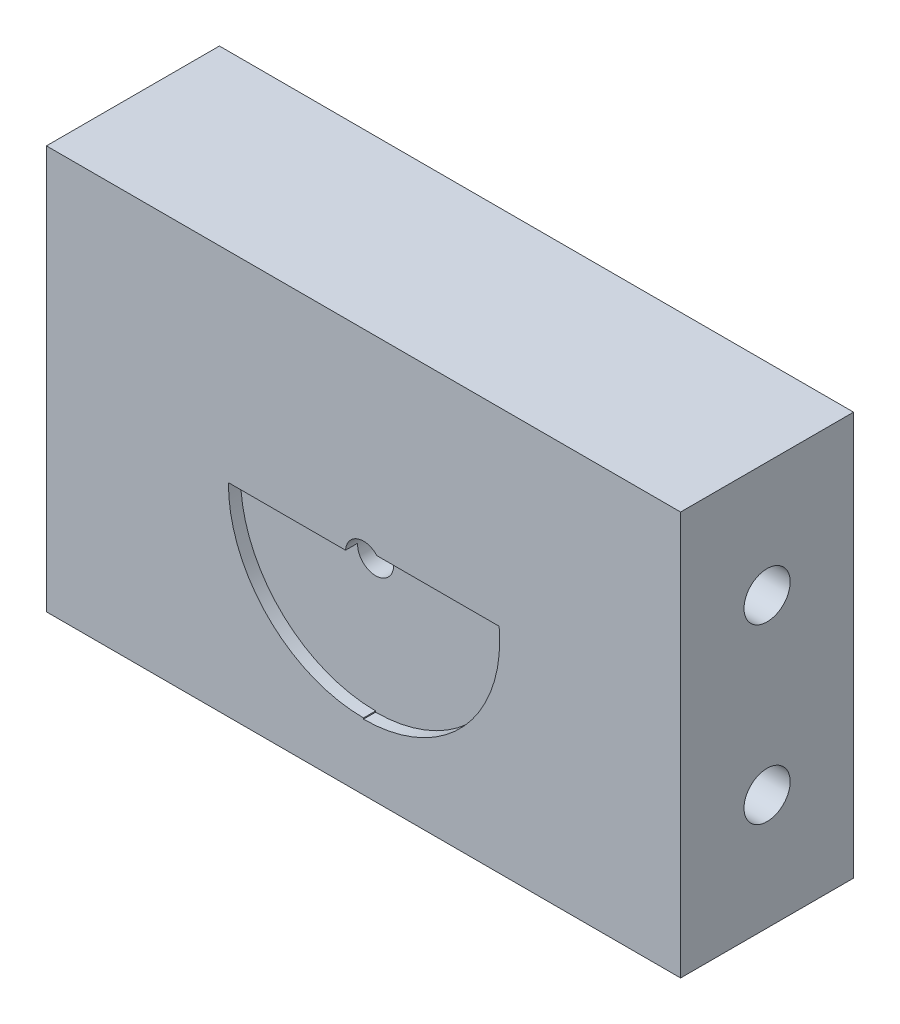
SolidWorks part; units mm, degrees
ref_plane "Plane1" through (0, 0, 0) normal (0, 0, 1) x (1, 0, 0)
ref_plane "Plane2" through (0, 0, 0) normal (0, 1, 0) x (1, 0, 0)
ref_plane "Plane3" through (0, 0, 0) normal (1, 0, 0) x (0, 0, -1)
imported_body "Imported1"
sketch "Sketch1" plane through (0, 0, 19.05) normal (0, 0, 1) x (1, 0, 0)
  line L0 (0, 2.667) -> (0, -30)
  line L2 (0, 2.667) -> (29.8812, 2.667)
  arc A0 (0, -30) -> (29.8812, 2.667) centre (0, 0) ccw
  circle A1 centre (0, 0) radius 3.9688 construction
  dimension "D1" = 60
  dimension "D2" = 2.667
extrude "Cut-Extrude1" cut sketch "Sketch1" against normal blind 2.667
sketch "Sketch2" plane through (0, 0, 19.05) normal (0, 0, 1) x (1, 0, 0)
  line L0 (2.9391, 0.254) -> (-29.7549, 0.254)
  line L1 (2.9391, 0.254) -> (2.9391, -29.6105)
  arc A0 (-29.7549, 0.254) -> (2.9391, -29.6105) centre (0, 0) ccw
  dimension "D1" = 0.254
extrude "Cut-Extrude2" cut sketch "Sketch2" against normal blind 2.667
sketch "Sketch3" plane through (0, 0, -19.05) normal (0, 0, -1) x (-1, 0, 0)
  line L0 (-69.85, 0) -> (0, 0) construction
  line L1 (-69.85, -44.45) -> (-69.85, 44.45) construction
  line L2 (0, 0) -> (0, -44.45) construction
  line L3 (69.85, -44.45) -> (-69.85, -44.45) construction
  circle A0 centre (-19.05, 0) radius 3.175
  circle A1 centre (19.05, 0) radius 3.175
  dimension "D1" = 6.35
  dimension "D2" = 19.05
extrude "Cut-Extrude3" cut sketch "Sketch3" against normal blind 6.35
